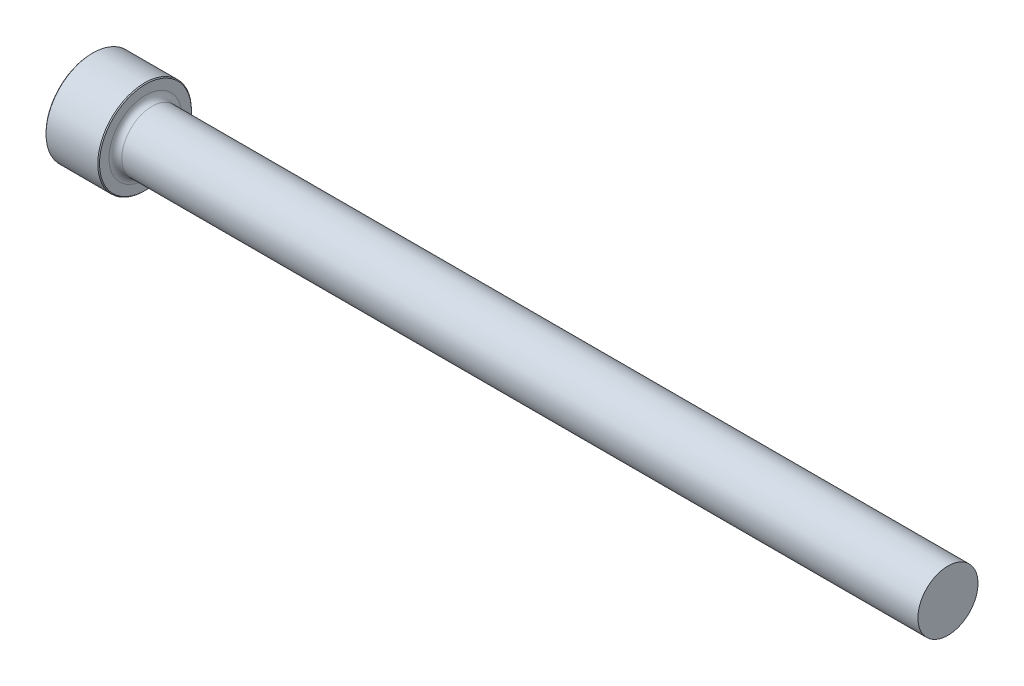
SolidWorks part; units mm, degrees
ref_plane "Front Plane" through (0, 0, 0) normal (0, 0, 1) x (1, 0, 0)
ref_plane "Top Plane" through (0, 0, 0) normal (0, 1, 0) x (1, 0, 0)
ref_plane "Right Plane" through (0, 0, 0) normal (1, 0, 0) x (0, 0, -1)
sketch "Sketch1" plane through (0, 0, 0) normal (0, 0, 1) x (1, 0, 0)
  line L0 (0, 0) -> (0, 5.5562)
  line L1 (0, 5.5562) -> (6.35, 5.5562)
  line L2 (6.35, 5.5562) -> (6.35, 4.3301)
  line L3 (7.112, 3.5681) -> (101.6, 3.5681)
  line L4 (101.6, 3.5681) -> (101.6, 0)
  line L5 (101.6, 0) -> (0, 0)
  line L6 (101.6, 0) -> (101.6, -3.5681) construction
  line L7 (101.6, -3.5681) -> (6.35, -3.5681) construction
  line L8 (0, 0) -> (0, -5.5562) construction
  line L9 (0, -5.5562) -> (6.35, -5.5562) construction
  line L10 (6.35, -5.5562) -> (6.35, -3.5681) construction
  arc A0 (6.35, 4.3301) -> (7.112, 3.5681) centre (7.112, 4.3301) ccw
  dimension "D4" = 0.762
  dimension "L" = 101.6
  dimension "D" = 7.1361
  dimension "H" = 11.1125
  dimension "T" = 6.35
revolve "Revolve1" add sketch "Sketch1" angle 360 about L5
chamfer "Chamfer1" distance 0.1016 angle 45 2 edges at (0, 5.5562, 0) (6.35, 5.5562, 0)
